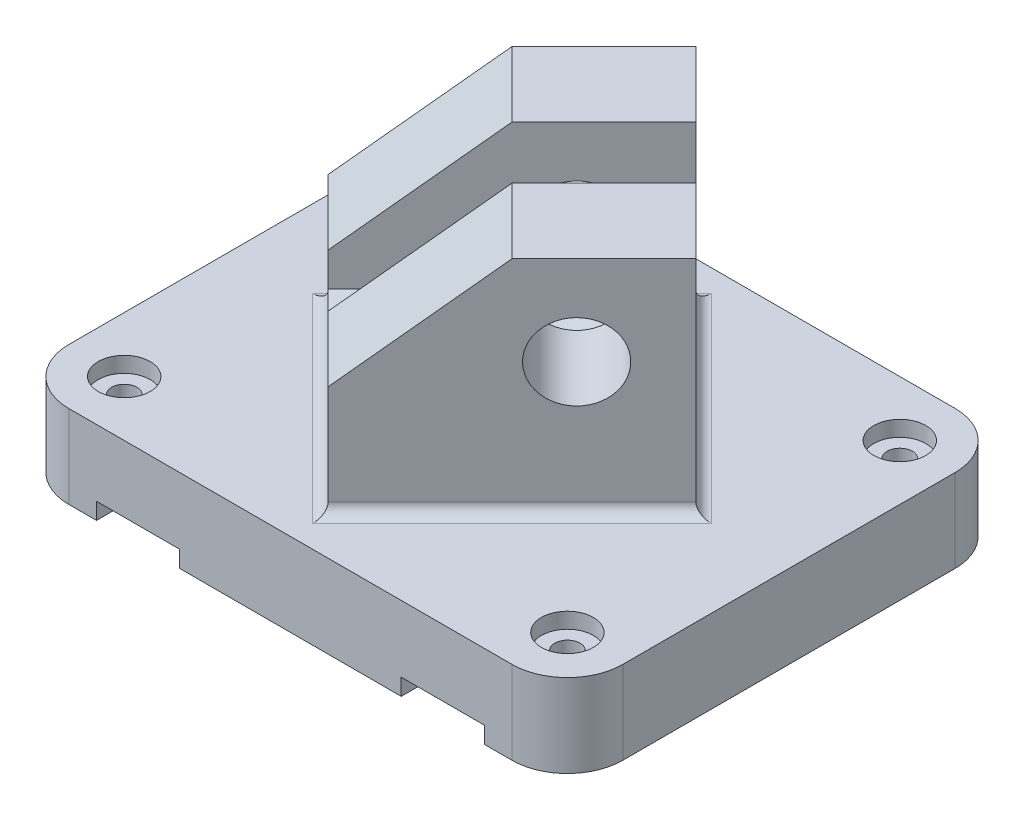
SolidWorks part; units mm, degrees
ref_plane "Front" through (0, 0, 0) normal (0, 0, 1) x (1, 0, 0)
ref_plane "Top" through (0, 0, 0) normal (0, 1, 0) x (1, 0, 0)
ref_plane "Right" through (0, 0, 0) normal (1, 0, 0) x (0, 0, -1)
sketch "Sketch1" plane through (0, 0, 0) normal (0, 1, 0) x (1, 0, 0)
  line L0 (-63.5, 50.8) -> (63.5, -50.8) construction
  line L1 (-63.5, 50.8) -> (63.5, 50.8)
  line L2 (-63.5, 50.8) -> (-63.5, -50.8)
  line L3 (-63.5, -50.8) -> (63.5, -50.8)
  line L4 (63.5, 50.8) -> (63.5, -50.8)
  dimension "D1" = 101.6
  dimension "D2" = 127
extrude "Extrude1" add sketch "Sketch1" along normal mid plane 19.05
sketch "Sketch8" plane through (0, 9.525, 0) normal (0, 1, 0) x (-1, 0, 0)
  line L0 (0, -42.1368) -> (42.1368, 0)
  line L1 (42.1368, 0) -> (0, 42.1368)
  line L2 (0, 42.1368) -> (-42.1368, 0)
  line L3 (-42.1368, 0) -> (0, -42.1368)
  line L4 (0, -42.1368) -> (0, 42.1368) construction
extrude "Extrude2" add sketch "Sketch8" along normal blind 50.8
sketch "Sketch9" plane through (21.0684, 0, 21.0684) normal (0.7071, 0, 0.7071) x (0.7071, 0, -0.7071)
  line L0 (-29.7952, 34.925) -> (0, 60.325)
  line L1 (-29.7952, 60.325) -> (-29.7952, 9.525) construction
  line L2 (-29.7952, 60.325) -> (29.7952, 60.325) construction
extrude "Cut-Extrude5" cut sketch "Sketch9" against normal through all and the other way through all
sketch "Sketch11" plane through (-21.0684, 0, 21.0684) normal (-0.7071, 0, 0.7071) x (0.7071, 0, 0.7071)
  line L0 (0, 9.525) -> (0, 72.3209) construction
  line L1 (0, 24.143) -> (8.5782, 27.1706)
  line L2 (8.5782, 27.1706) -> (8.5782, 60.325)
  line L3 (-29.7952, 60.325) -> (29.7952, 60.325) construction
  line L4 (-8.5782, 27.1706) -> (-8.5782, 60.325)
  line L5 (0, 24.143) -> (-8.5782, 27.1706)
  line L6 (8.5782, 60.325) -> (-8.5782, 60.325)
  line L7 (-29.7952, 9.525) -> (29.7952, 9.525) construction
extrude "Cut-Extrude6" cut sketch "Sketch11" against normal through all
sketch "Sketch12" plane through (21.0684, 0, 21.0684) normal (0.7071, 0, 0.7071) x (0.7071, 0, -0.7071)
  circle A0 centre (10.476, 39.8599) radius 8.7739
extrude "Cut-Extrude7" cut sketch "Sketch12" against normal through all
sketch "Sketch13" plane through (0, 0, 50.8) normal (0, 0, 1) x (1, 0, 0)
  line L0 (-63.5, -9.525) -> (63.5, -9.525) construction
  line L1 (25.4, -9.525) -> (44.45, -9.525)
  line L2 (25.4, -9.525) -> (25.4, -5.715)
  line L3 (25.4, -5.715) -> (44.45, -5.715)
  line L4 (44.45, -9.525) -> (44.45, -5.715)
  line L5 (63.5, 9.525) -> (63.5, -9.525) construction
  dimension "D1" = 19.05
  dimension "D2" = 19.05
  dimension "D3" = 3.81
extrude "Cut-Extrude8" cut sketch "Sketch13" against normal through all
fillet "Fillet2" radius 2.54
fillet "Fillet1" radius 12.7
hole_wizard "CBORE for #12 Binding Head Machine Screw1" positions "Sketch16" profile "Sketch15" counterbore size "#12" standard "Ansi Inch"
sketch "Sketch16" plane through (0, 9.525, 0) normal (0, 1, 0) x (-1, 0, 0)
  arc A0 (63.5, 38.1) -> (50.8, 50.8) centre (50.8, 38.1) ccw construction
  point P0 (50.8, 38.1)
sketch "Sketch15" plane through (-50.8, 9.525, 38.1) normal (1, 0, 0) x (0, 0, 1)
  line L0 (0, 0) -> (0, 27.1399)
  line L1 (0, 27.1399) -> (2.8956, 25.4)
  line L2 (2.8956, 25.4) -> (2.8956, 3.5814)
  line L3 (2.8956, 3.5814) -> (5.9538, 3.5814)
  line L4 (5.9538, 3.5814) -> (5.9538, 0)
  line L5 (5.9538, 0) -> (0, 0)
  line L10 (0, 27.1399) -> (-2.8956, 25.4) construction
  line L11 (0, -6.35) -> (0, 107.95) construction
  dimension "Hole Dia." = 5.7912
  dimension "Hole Depth" = 25.4
  dimension "C'Bore Dia." = 11.9075
  dimension "C'Bore Depth" = 3.5814
  dimension "Drill Angle" = 118
mirror "Mirror1" about plane through (0, 0, 0) normal (1, 0, 0)
mirror "Mirror2" about plane through (0, 0, 0) normal (0, 0, 1)
